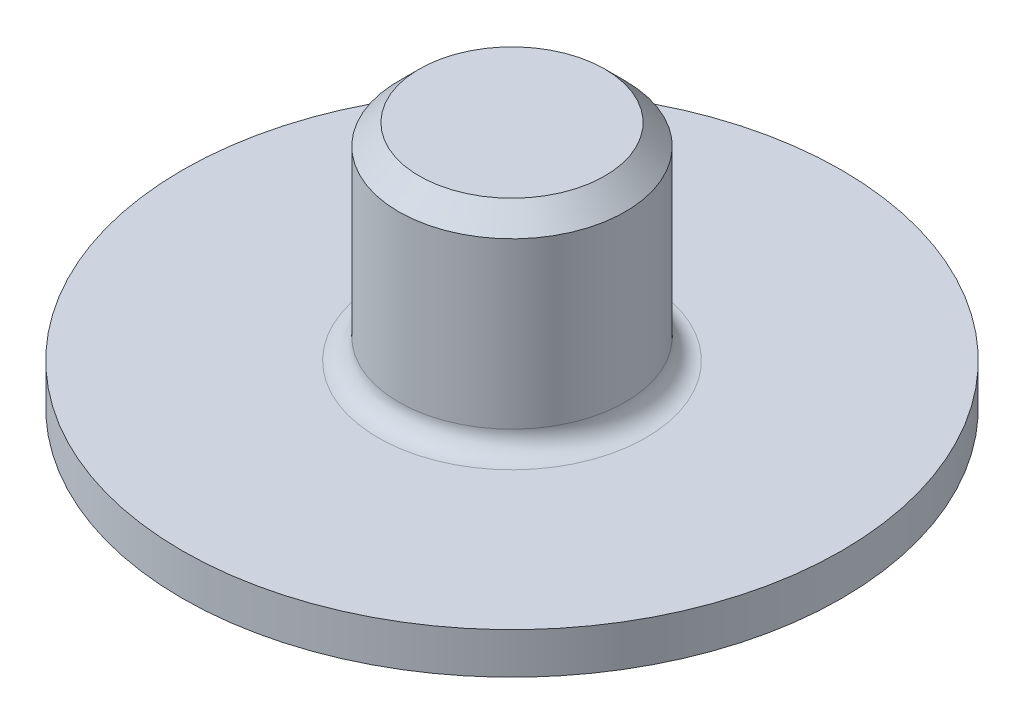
SolidWorks part; units mm, degrees
ref_plane "Plan de face" through (0, 0, 0) normal (0, 0, 1) x (1, 0, 0)
ref_plane "Plan de dessus" through (0, 0, 0) normal (0, 1, 0) x (1, 0, 0)
ref_plane "Plan de droite" through (0, 0, 0) normal (1, 0, 0) x (0, 0, -1)
sketch "Esquisse1" plane through (0, 0, 0) normal (0, 0, 1) x (1, 0, 0)
  line L0 (0, 0) -> (0, 48.2641) construction
  line L1 (0, 0) -> (-16, 0)
  line L2 (-16, 0) -> (-16, 2)
  line L3 (-16, 2) -> (-5.5, 2)
  line L4 (-5.5, 2) -> (-5.5, 12)
  line L5 (-5.5, 12) -> (0, 12)
  line L6 (0, 12) -> (0, 0)
  dimension "D1" = 5.5
  dimension "D2" = 16
  dimension "D3" = 10
  dimension "D4" = 2
revolve "Révolution1" add sketch "Esquisse1" angle 360 about L0
chamfer "Chanfrein1" distance 1 angle 45 1 edges at (0, 12, -5.5)
fillet "Congé1" radius 1 1 edges at (0, 2, -5.5)
